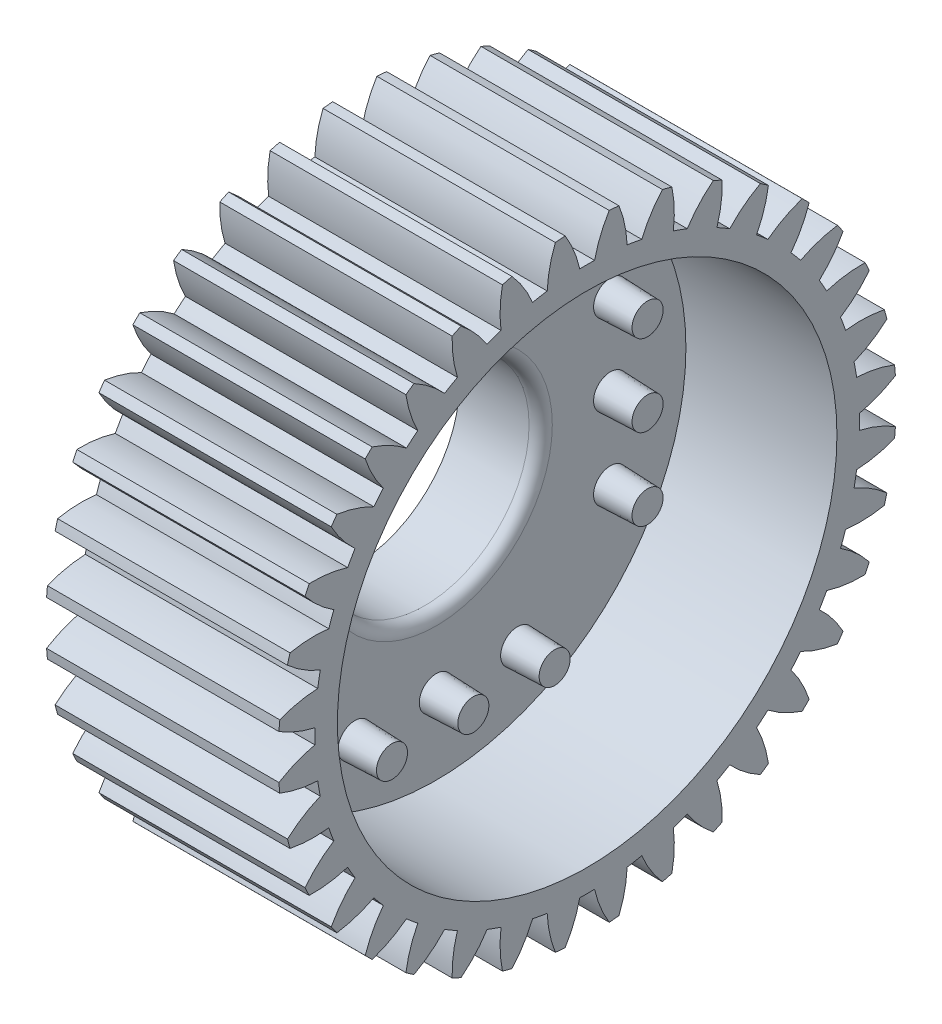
SolidWorks part; units mm, degrees
ref_plane "Plane1" through (0, 0, 0) normal (0, 0, 1) x (1, 0, 0)
ref_plane "Plane2" through (0, 0, 0) normal (0, 1, 0) x (1, 0, 0)
ref_plane "Plane3" through (0, 0, 0) normal (1, 0, 0) x (0, 0, -1)
sketch "HoldingSke" plane through (0, 0, 0) normal (0, 1, 0) x (1, 0, 0)
  line L0 (0, 0) -> (1.1557, -0.8397)
  line L1 (-15, 0) -> (100, 0) construction
  line L2 (0, 0) -> (-2.1039, 2.3779)
  line L3 (0, 0) -> (-11.863, 4.5341)
  line L4 (0, 0) -> (6.9867, 5.0761)
  line L5 (0, 0) -> (-46.8476, -17.4728)
  line L6 (0, 0) -> (-8.2896, -5.593)
  line L7 (-2.1039, 2.3779) -> (8.6586, 51.2059)
  line L8 (-76.2, 54.61) -> (-72.9, 54.61)
  line L9 (-71.009, 38.7566) -> (-53.1078, 45.2721)
  line L10 (-76.2, 71.12) -> (104.1128, 71.12)
  line L11 (0, 0) -> (-10, 0)
  line L12 (-76.2, 101.6) -> (-76.173, 101.6)
  line L13 (24.9733, 27.94) -> (52.9518, 28.4284)
  line L14 (24.9733, 27.94) -> (24.9743, 27.94)
  line L15 (24.9733, 27.94) -> (100.4006, 29.5858)
  line L16 (-63.627, -0.7) -> (-12.827, -0.7)
  circle A0 centre (0, 0) radius 11
  circle A1 centre (0, 0) radius 11.724
  circle A2 centre (0, 0) radius 37.5
  circle A3 centre (0, 0) radius 11
  dimension "MHD" = 23.448
  dimension "Hub_dia" = 75
  dimension "Bore" = 22
  dimension "MBD" = 22
  dimension "Num_teeth" = 36
  dimension "Pitch_radius" = 180.3128
  dimension "Pitch" = 1.4286
  dimension "Width" = 10
  dimension "Overall_len" = 50
  dimension "Show_teeth" = 36
  dimension "Thickness" = 10
  dimension "OAL" = 50.0001
  dimension "T_dim" = 3.3
  dimension "Ap" = 20
  dimension "H" = 19.05
  dimension "Backlash" = 0.027
  dimension "Addendum_fac" = 1
  dimension "Dedendum_fac" = 1.25
  dimension "Clearance_fac" = 0.25
  dimension "Dedendum_add" = 0.001
  dimension "Module" = 0.7
sketch "BasProSke" plane through (0, 0, 0) normal (0, 1, 0) x (1, 0, 0)
  line L0 (-10, 0) -> (60, 0) construction
  line L1 (0, 0) -> (0, 13.3)
  line L2 (0, 0) -> (10, 0)
  line L3 (10, 0) -> (10, 13.3)
  line L4 (10, 13.3) -> (0, 13.3)
  dimension "Diameter" = 26.6
  dimension "Thickness" = 10
revolve "Base-Revolve" add sketch "BasProSke" angle 360 about L0
sketch "TooCutSke" plane through (0, 0, 0) normal (1, 0, 0) x (0, 0, -1)
  line L1 (0, 0) -> (0, 107) construction
  line L2 (0, 0) -> (-0.5968, 12.5859) construction
  line L3 (0, 0) -> (-2.1946, 25.0841) construction
  line L4 (-0.5968, 12.5859) -> (-1.0973, 12.5421) construction
  arc A0 (0.3189, 11.7197) -> (-0.3189, 11.7197) centre (0, 0) ccw
  arc A1 (0.9635, 13.2905) -> (-0.9635, 13.2905) centre (0, 0) ccw
  circle A2 centre (0, 0) radius 12.6 construction
  circle A3 centre (0, 0) radius 11.8401 construction
  arc A4 (-0.3189, 11.7197) -> (-0.9635, 13.2905) centre (-5.2372, 10.6189) ccw
  arc A5 (0.9635, 13.2905) -> (0.3189, 11.7197) centre (5.2372, 10.6189) ccw
  dimension "Root_dia" = 23.448
  dimension "Overcut_dia" = 26.6508
  dimension "Pitch_dia" = 25.2
  dimension "Base_dia" = 23.6803
  dimension "Flank_rad" = 5.04
  dimension "Half_ang" = 5
  dimension "Half_CT" = 0.5024
extrude "ToothCut" cut sketch "TooCutSke" along normal through all
fillet "Breaks" [suppressed] radius 0.014
fillet "RootFillets" [suppressed] radius 0.176
pattern_circular "TeethCuts" count 36 over 360 about axis through (0, 0, 0) along (1, 0, 0) of "ToothCut", "RootFillets", "Breaks"
sketch "HubNeaOneSke" plane through (0, 0, 0) normal (-1, 0, 0) x (0, 0, 1)
  circle A0 centre (0, 0) radius 11.724
  dimension "Diameter" = 23.448
extrude "HubNearOne" [suppressed] add sketch "HubNeaOneSke" along normal blind 40.0001
sketch "HubNeaBotSke" plane through (0, 0, 0) normal (-1, 0, 0) x (0, 0, 1)
  circle A0 centre (0, 0) radius 11.724
  dimension "Diameter" = 23.448
extrude "HubNearBoth" [suppressed] add sketch "HubNeaBotSke" along normal blind 20
ref_plane "FarPln" through (10, 0, 0) normal (1, 0, 0) x (0, 0, -1)
sketch "HubFarSke" plane through (10, 0, 0) normal (1, 0, 0) x (0, 0, -1)
  circle A0 centre (0, 0) radius 11.724
  dimension "Diameter" = 23.448
extrude "HubFar" [suppressed] add sketch "HubFarSke" along normal blind 20
sketch "BorSke" plane through (0, 0, 0) normal (1, 0, 0) x (0, 0, -1)
  circle A0 centre (0, 0) radius 11
  dimension "Diameter" = 22
extrude "Bore" cut sketch "BorSke" along normal mid plane 100.0001
sketch "KeySke" plane through (0, 0, 0) normal (1, 0, 0) x (0, 0, -1)
  line L0 (-4, 0) -> (-4, 14.3)
  line L1 (-4, 14.3) -> (4, 14.3)
  line L2 (4, 14.3) -> (4, 0)
  line L3 (0, 0) -> (0, 34) construction
  line L4 (-4, 0) -> (4, 0)
  dimension "Offset" = 14.3
  dimension "Width" = 8
extrude "Keyway" [suppressed] cut sketch "KeySke" along normal mid plane 100.0001
pattern_circular "Keyway2" [suppressed] count 2 every 90 about axis through (-10, 0, 0) along (1, 0, 0)
sketch "Sketch1" plane through (0, 0, 0) normal (1, 0, 0) x (0, 0, -1)
  circle A0 centre (0, 0) radius 11
  circle A1 centre (0, 0) radius 4.5
extrude "Boss-Extrude1" add sketch "Sketch1" along normal blind 3.5
sketch "Sketch2" plane through (10, 0, 0) normal (1, 0, 0) x (0, 0, -1)
  circle A0 centre (0, 0) radius 11
  circle A1 centre (0, 0) radius 10.75
extrude "Boss-Extrude2" add sketch "Sketch2" against normal blind 10
sketch "Sketch3" plane through (3.5, 0, 0) normal (1, 0, 0) x (0, 0, -1)
  line L0 (0, 0) -> (0, 7.5) construction
  line L1 (0, 7.5) -> (-3.5, 7.5) construction
  line L2 (0, 0) -> (-5.9246, 5.9246) construction
  line L3 (0, 0) -> (-4.9028, 0) construction
  circle A0 centre (-3.5, 7.5) radius 0.725
  circle A1 centre (0, 7.5) radius 0.725
  circle A2 centre (3.5, 7.5) radius 0.725
  circle A3 centre (-7.5, -3.5) radius 0.725
  circle A4 centre (-7.5, 0) radius 0.725
  circle A5 centre (-7.5, 3.5) radius 0.725
  circle A6 centre (7.5, -3.5) radius 0.725
  circle A7 centre (7.5, 0) radius 0.725
  circle A8 centre (7.5, 3.5) radius 0.725
  circle A9 centre (3.5, -7.5) radius 0.725
  circle A10 centre (0, -7.5) radius 0.725
  circle A11 centre (-3.5, -7.5) radius 0.725
  dimension "D3" = 45
  dimension "D4" = 1.45
  dimension "D5" = 1.45
  dimension "D1" = 7.5
  dimension "D2" = 3.5
extrude "Boss-Extrude3" add sketch "Sketch3" along normal blind 1.6 draft 2
fillet "Fillet1" radius 0.5 1 edges at (3.5, 0, -4.5)
equation "' \"Module@HoldingSke\" = 6.35"
equation "' \"Num_teeth@HoldingSke\" = 12"
equation "' \"Ap@HoldingSke\" =  20"
equation "' \"Width@HoldingSke\" = 0.5 * 25.4"
equation "' \"Hub_dia@HoldingSke\"= 1 * 25.4"
equation "' \"Overall_len@HoldingSke\" = 1.0 * 25.4"
equation "' \"Bore@HoldingSke\" = 0.75 * 25.4"
equation "' \"T_dim@HoldingSke\" = 0.1 * 25.4"
equation "' \"Width@KeySke\" = 0.25 * 25.4"
equation "' \"Show_teeth@HoldingSke\" = 13"
equation "' \"Backlash@HoldingSke\" = 0.009 * 25.4"
equation "' \"Addendum_fac@HoldingSke\" = 1.0"
equation "' \"Dedendum_fac@HoldingSke\" = 1.25"
equation "' \"Dedendum_add@HoldingSke\" = 0.00005 * 25.4"
equation "' \"Clearance_fac@HoldingSke\" = 0.25"
equation "\"Pitch@HoldingSke\" = 1 / \"Module@HoldingSke\""
equation "\"Overcut_dia@TooCutSke\" = (\"Num_teeth@HoldingSke\" + 2 * \"Addendum_fac@HoldingSke\") / \"Pitch@HoldingSke\" + 0.002 * 25.4"
equation "\"Pitch_dia@TooCutSke\" = \"Num_teeth@HoldingSke\" / \"Pitch@HoldingSke\""
equation "\"Base_dia@TooCutSke\" = \"Num_teeth@HoldingSke\" / \"Pitch@HoldingSke\" * cos((\"Ap@HoldingSke\"  * 3.14159265 / 180))"
equation "\"Root_dia@TooCutSke\" = (\"Num_teeth@HoldingSke\" + 2) / \"Pitch@HoldingSke\" - 2 * (\"Addendum_fac@HoldingSke\" + \"Dedendum_fac@HoldingSke\") / \"Pitch@HoldingSke\" - \"Dedendum_add@HoldingSke\" * 2"
equation "\"Half_ang@TooCutSke\" = 180 / \"Num_teeth@HoldingSke\""
equation "\"Half_CT@TooCutSke\" = \"Num_teeth@HoldingSke\" / \"Pitch@HoldingSke\" * sin((3.14159265 / 2 / \"Num_teeth@HoldingSke\")) / 2 - 7 * \"Backlash@HoldingSke\" / 4"
equation "\"Flank_rad@TooCutSke\" = \"Num_teeth@HoldingSke\" / \"Pitch@HoldingSke\" / 5"
equation "\"Radius@RootFillets\" = \"Clearance_fac@HoldingSke\" / \"Pitch@HoldingSke\" + \"Dedendum_add@HoldingSke\""
equation "\"Break_rad@Breaks\" = 0.02 / \"Pitch@HoldingSke\""
equation "\"Thickness@HoldingSke\" = \"Width@HoldingSke\""
equation "\"OAL@HoldingSke\" = \"Thickness@HoldingSke\""
equation "\"MHD@HoldingSke\" = (\"Num_teeth@HoldingSke\" + 2) / \"Pitch@HoldingSke\" - 2 * (\"Addendum_fac@HoldingSke\" + \"Dedendum_fac@HoldingSke\")  / \"Pitch@HoldingSke\" - \"Dedendum_add@HoldingSke\" * 2"
equation "\"MBD@HoldingSke\" = (\"Num_teeth@HoldingSke\" + 2) / \"Pitch@HoldingSke\" - 2 * (\"Addendum_fac@HoldingSke\" + \"Dedendum_fac@HoldingSke\")  / \"Pitch@HoldingSke\" - \"Dedendum_add@HoldingSke\" * 2 - 0.002 * 25.4"
equation "\"MHD@HoldingSke\" = ((sgn( \"MHD@HoldingSke\" - \"Hub_dia@HoldingSke\" )-1)*( \"MHD@HoldingSke\" - \"Hub_dia@HoldingSke\" ))/-2+ \"Hub_dia@HoldingSke\""
equation "\"MBD@HoldingSke\" = ((sgn( \"MBD@HoldingSke\" - \"Bore@HoldingSke\" )-1)*( \"MBD@HoldingSke\" - \"Bore@HoldingSke\" ))/-2+ \"Bore@HoldingSke\""
equation "\"OAL@HoldingSke\" = ((sgn( \"OAL@HoldingSke\" - \"Overall_len@HoldingSke\" )+1)*( \"OAL@HoldingSke\" - \"Overall_len@HoldingSke\" ))/2 + \"Overall_len@HoldingSke\" + 0.000002 * 25.4"
equation "\"Num_teeth@TeethCuts\" = int( \"Show_teeth@HoldingSke\" ) + 1"
equation "\"Num_teeth@TeethCuts\" = ((sgn( \"Num_teeth@TeethCuts\" - \"Num_teeth@HoldingSke\" )-1)*( \"Num_teeth@TeethCuts\" - \"Num_teeth@HoldingSke\" ))/-2+ \"Num_teeth@HoldingSke\""
equation "\"Num_teeth@TeethCuts\" = ((sgn( \"Num_teeth@TeethCuts\" - 2.0)+1)*( \"Num_teeth@TeethCuts\" - 2.0))/2 +2.0"
equation "\"Angle@TeethCuts\" = 360.0 / \"Num_teeth@HoldingSke\""
equation "\"Diameter@BasProSke\" = (\"Num_teeth@HoldingSke\" + 2 * \"Addendum_fac@HoldingSke\") / \"Pitch@HoldingSke\""
equation "\"Thickness@BasProSke\"  = \"Thickness@HoldingSke\""
equation "' \"Fillet_rad@BasProSke\" =  \"Thickness@HoldingSke\" * 0.05"
equation "\"MHD@HoldingSke\" = ((sgn( \"MHD@HoldingSke\" - \"Root_dia@TooCutSke\" )-1)*( \"MHD@HoldingSke\" - \"Root_dia@TooCutSke\" ))/-2+ \"Root_dia@TooCutSke\""
equation "\"Diameter@HubNeaOneSke\" = \"MHD@HoldingSke\""
equation "\"Length@HubNearOne\" = \"OAL@HoldingSke\" - \"Thickness@BasProSke\""
equation "\"Diameter@HubNeaBotSke\" = \"MHD@HoldingSke\""
equation "\"Length@HubNearBoth\" = ( \"OAL@HoldingSke\" - \"Thickness@BasProSke\" ) / 2.0"
equation "\"Thickness@FarPln\" = \"Thickness@BasProSke\""
equation "\"Diameter@HubFarSke\" = \"MHD@HoldingSke\""
equation "\"Length@HubFar\" = ( \"OAL@HoldingSke\" - \"Thickness@BasProSke\" ) / 2.0"
equation "\"Diameter@BorSke\" = \"MBD@HoldingSke\""
equation "\"D1@Bore\" = \"OAL@HoldingSke\" * 2.0"
equation "\"D1@Keyway\" = \"OAL@HoldingSke\" * 2.0"
equation "\"Offset@KeySke\" = \"T_dim@HoldingSke\" + \"MBD@HoldingSke\" / 2.0"
